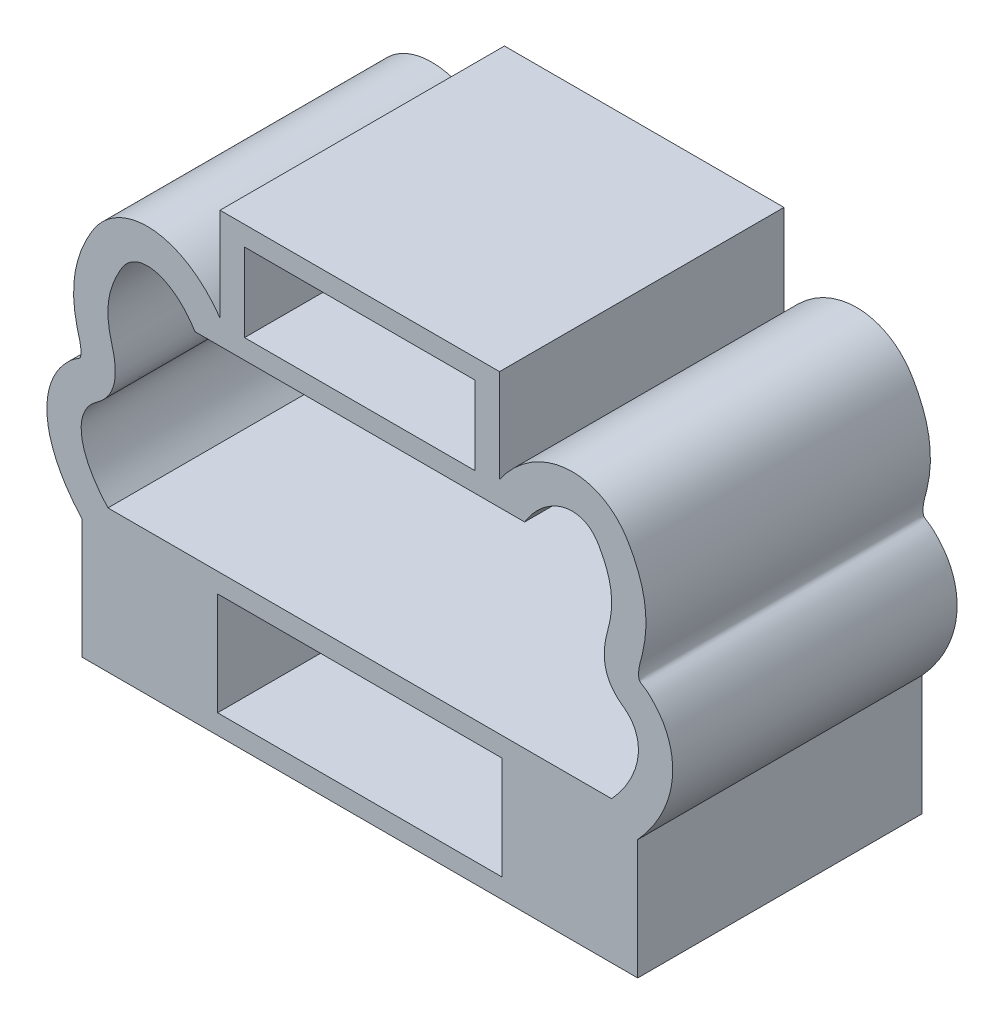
SolidWorks part; units mm, degrees
ref_plane "前视基准面" through (0, 0, 0) normal (0, 0, 1) x (1, 0, 0)
ref_plane "上视基准面" through (0, 0, 0) normal (0, 1, 0) x (1, 0, 0)
ref_plane "右视基准面" through (0, 0, 0) normal (1, 0, 0) x (0, 0, -1)
sketch "Model" plane through (0, 0, 0) normal (0, 0, 1) x (1, 0, 0)
  line L0 (5.1358, 0) -> (0, 0)
  line L1 (1.7742, 4) -> (5.1358, 4)
  line L2 (5.1358, 4) -> (5.1358, 4.4)
  line L3 (5.1358, 4.4) -> (2.7858, 4.4)
  line L4 (2.7858, 4.4) -> (2.7858, 6)
  line L5 (2.7858, 6) -> (5.1358, 6)
  line L6 (5.1358, 6) -> (5.1358, 6.4)
  line L7 (5.1358, 6.4) -> (2.2858, 6.4)
  line L8 (2.2858, 6.4) -> (2.2858, 4.4962)
  line L9 (-0.5318, -0.4552) -> (-0.5318, -2.9)
  line L10 (-0.5318, -2.9) -> (5.1358, -2.9)
  line L11 (5.1358, -2.9) -> (5.1358, -2.5)
  line L12 (5.1358, -2.5) -> (2.2358, -2.5)
  line L13 (2.2358, -2.5) -> (2.2358, -0.4)
  line L14 (2.2358, -0.4) -> (5.1358, -0.4)
  line L15 (5.1358, -0.4) -> (5.1358, 0)
  spline S0 degree 3 number of poles 148 (0, 0) -> (1.7742, 4)
  spline S1 degree 3 number of poles 145 (2.2858, 4.4962) -> (-0.5318, -0.4552)
extrude "凸台-拉伸1" add sketch "Model" along normal blind 5.8
ref_plane "基准面4" through (5.1358, 0, 0) normal (1, 0, 0) x (0, 0, -1)
mirror "镜向1" about plane through (5.1358, 0, 0) normal (1, 0, 0) of "凸台-拉伸1"
